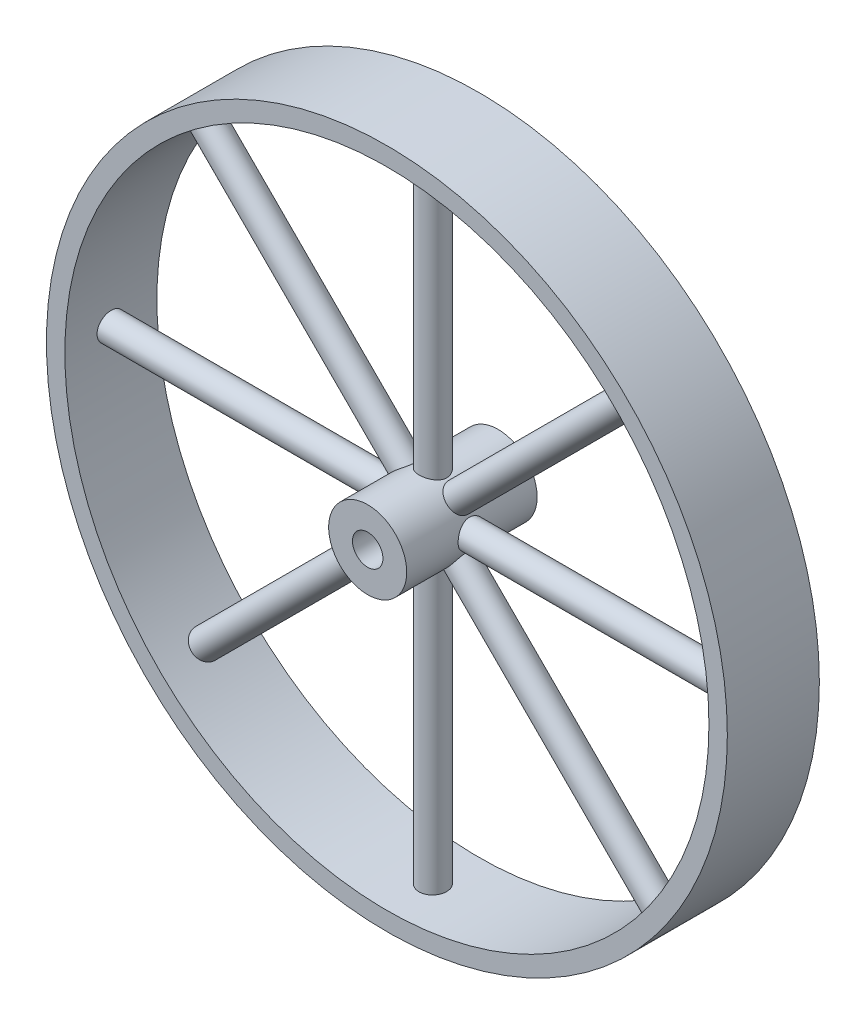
SolidWorks part; units mm, degrees
ref_plane "Front Plane" through (0, 0, 0) normal (0, 0, 1) x (1, 0, 0)
ref_plane "Top Plane" through (0, 0, 0) normal (0, 1, 0) x (1, 0, 0)
ref_plane "Right Plane" through (0, 0, 0) normal (1, 0, 0) x (0, 0, -1)
sketch "Sketch1" plane through (0, 0, 0) normal (0, 0, 1) x (1, 0, 0)
  circle A0 centre (0, 0) radius 44.45
  dimension "D1" = 88.9
extrude "Extrude-Thin1" add sketch "Sketch1" along normal mid plane 12.7 thin
sketch "Sketch2" plane through (0, 0, 0) normal (0, 0, 1) x (1, 0, 0)
  circle A0 centre (0, 0) radius 2.1
  dimension "D1" = 4.2
extrude "Extrude-Thin2" add sketch "Sketch2" along normal mid plane 18 separate body thin
ref_plane "Plane1" through (11.43, 0, 0) normal (1, 0, 0) x (0, 0, -1)
sketch "Sketch3" plane through (11.43, 0, 0) normal (1, 0, 0) x (0, 0, -1)
  circle A0 centre (0, 0) radius 1.905
  dimension "D1" = 3.81
extrude "Boss-Extrude1" add sketch "Sketch3" along normal up to next and the other way up to next
pattern_circular "CirPattern1" count 8 over 360 about axis through (0, 0, 9) along (0, 0, -1) of "Boss-Extrude1"
